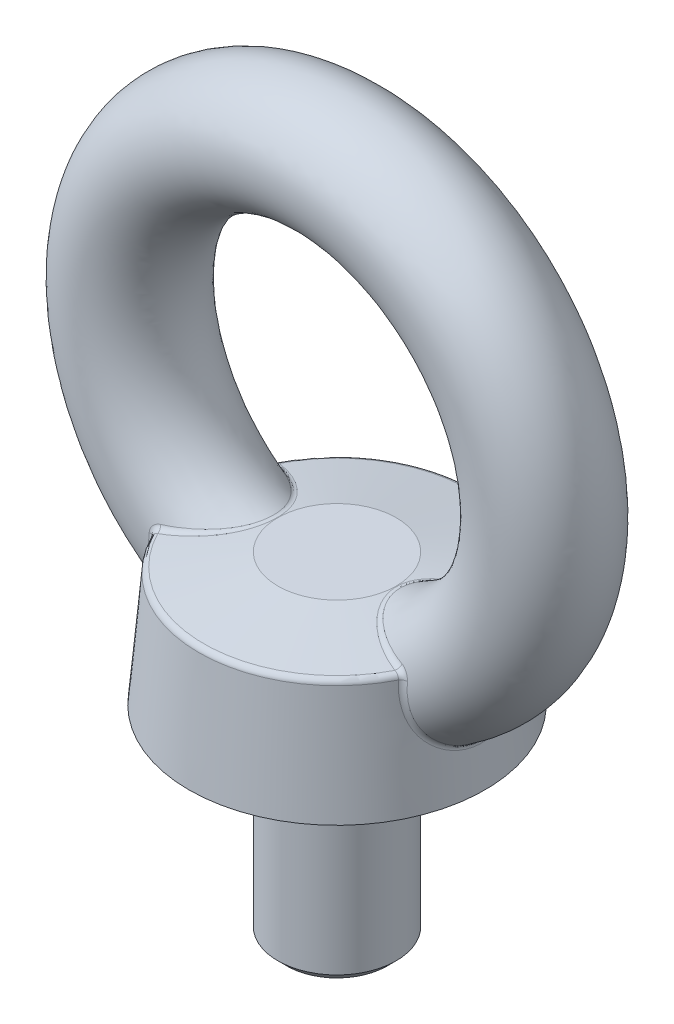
SolidWorks part; units mm, degrees
ref_plane "Front Plane" through (0, 0, 0) normal (0, 0, 1) x (1, 0, 0)
ref_plane "Top Plane" through (0, 0, 0) normal (0, 1, 0) x (1, 0, 0)
ref_plane "Right Plane" through (0, 0, 0) normal (1, 0, 0) x (0, 0, -1)
sketch "Sketch1" plane through (0, 0, 0) normal (0, 0, 1) x (1, 0, 0)
  ellipse E0 centre (0, 22.5) end of major axis (0, 0) minor radius 22.5
  dimension "D1" = 45
  dimension "D2" = 45
sketch "Sketch2" plane through (0, 0, 0) normal (1, 0, 0) x (0, 0, -1)
  line L3 (0, 45) -> (0, 0) construction
  circle A0 centre (0, 5) radius 5
  point P5 (0, 0)
sweep "Sweep1" add profiles "Sketch2" path "Sketch1"
sketch "Sketch3" plane through (0, 0, 0) normal (1, 0, 0) x (0, 0, -1)
  line L0 (0, 0) -> (-12.5, 0)
  line L1 (-12.5, 0) -> (-11.6251, 10)
  line L2 (-11.6251, 10) -> (-5, 11.1682)
  line L3 (-5, 11.1682) -> (0, 11.1682)
  line L4 (0, 11.1682) -> (0, 0)
revolve "Revolve1" add sketch "Sketch3" angle 360 about L4
fillet "Fillet1" radius 0.5 6 edges at (5.2368, 11.1223, 0.4932) (12.1744, 3.607, 0.4943) (-5.2368, 11.1223, -0.4932) (-12.1744, 3.607, -0.4943) (0, 10, -11.6251) (0, 10, 11.6251)
sketch "Sketch4" plane through (0, 0, 0) normal (0, -1, 0) x (1, 0, 0)
  circle A0 centre (0, 0) radius 5
  dimension "D1" = 10
extrude "Extrude1" add sketch "Sketch4" along normal blind 17
chamfer "Chamfer1" distance 0.75 angle 45 1 edges at (0, -17, -5)
sketch "Sketch5" plane through (0, 0, 0) normal (1, 0, 0) x (0, 0, -1)
  line L0 (-5, 0) -> (-5, -2.049)
  line L1 (-5, 0) -> (-5, -16.25) construction
  line L2 (-4.25, -0.75) -> (-5, -2.049)
  line L3 (-4.25, -0.75) -> (-4.25, -0.375)
  line L4 (-4.625, 0) -> (-5, 0)
  line L5 (-4.625, -0.375) -> (-4.25, -0.375) construction
  arc A1 (-4.25, -0.375) -> (-4.625, 0) centre (-4.625, -0.375) ccw
  point P0 (-4.25, -17)
  dimension "D1" = 30
revolve "Cut-Revolve1" cut sketch "Sketch5" angle 360 about axis through (0, -17, 0) along (0, 1, 0)
equation "\"D4@Sketch3\" = \"D1@Sketch2\""
equation "\"D5@Sketch3\" = \"D1@Sketch2\"/2"
